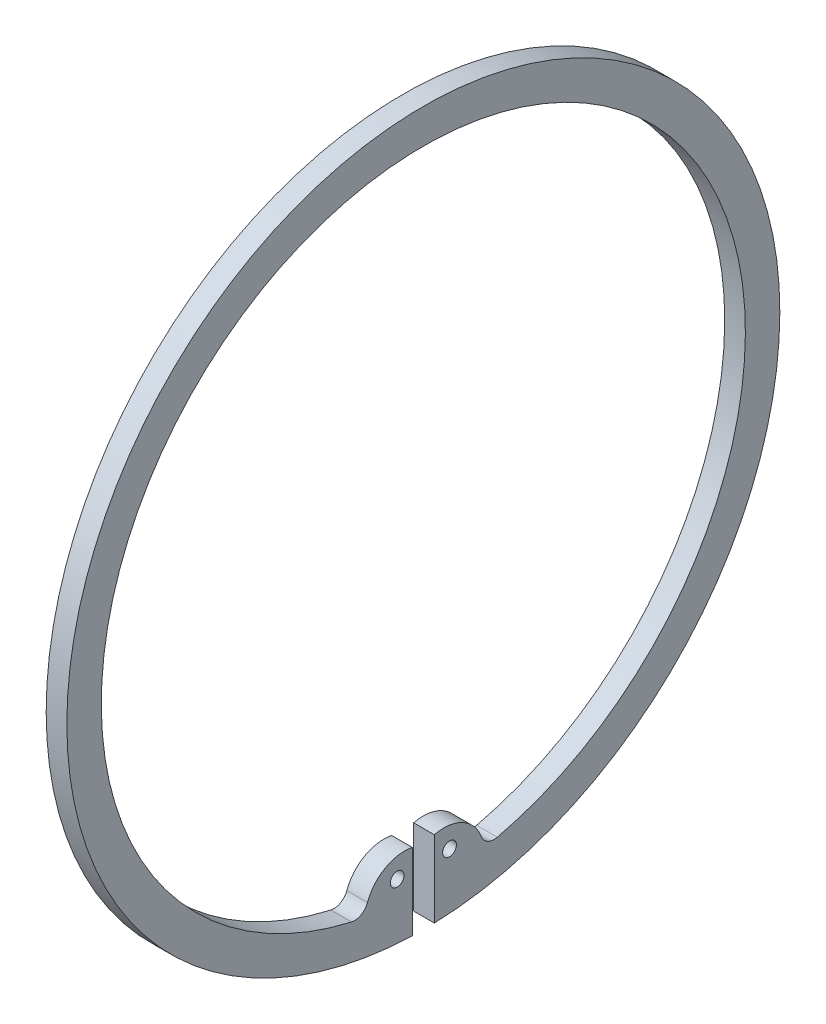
SolidWorks part; units mm, degrees
ref_plane "Plan1" through (0, 0, 0) normal (0, 0, 1) x (1, 0, 0)
ref_plane "Plan2" through (0, 0, 0) normal (0, 1, 0) x (1, 0, 0)
ref_plane "Plan3" through (0, 0, 0) normal (1, 0, 0) x (0, 0, -1)
sketch "Esquisse1" plane through (0, 0, 0) normal (1, 0, 0) x (0, 0, -1)
  line L3 (-1.6, -51.7253) -> (-1.6, -40.6092)
  line L4 (1.6, -51.7253) -> (1.6, -40.6177)
  arc A0 (1.6, -51.7253) -> (-1.6, -51.7253) centre (0, 0) ccw
  arc A1 (10.7414, -45.4993) -> (-10.4366, -45.5702) centre (0, 0) ccw
  arc A2 (1.6, -40.6177) -> (8.4037, -44.24) centre (2.9814, -46.2239) cw
  arc A3 (-10.4366, -45.5702) -> (-8.1071, -44.2947) centre (-9.9901, -43.6206) ccw
  arc A4 (8.4037, -44.24) -> (10.7414, -45.4993) centre (10.2819, -43.5528) ccw
  circle A5 centre (-3.8, -43.5) radius 1
  arc A11 (-8.1071, -44.2947) -> (-1.6, -40.6092) centre (-2.717, -46.2241) cw
  circle A12 centre (3.8, -43.5) radius 1
  dimension "D2" = 93.5
  dimension "D3" = 2
  dimension "D6" = 43.5
  dimension "D7" = 3.8
  dimension "D4" = 2
  dimension "D5" = 43.5
  dimension "D9" = 1.6
  dimension "D11" = 2
  dimension "D1" = 103.5
  dimension "D12" = 2
  dimension "D8" = 3.8
  dimension "D10" = 1.6
extrude "Base-Extrusion" add sketch "Esquisse1" along normal blind 3
